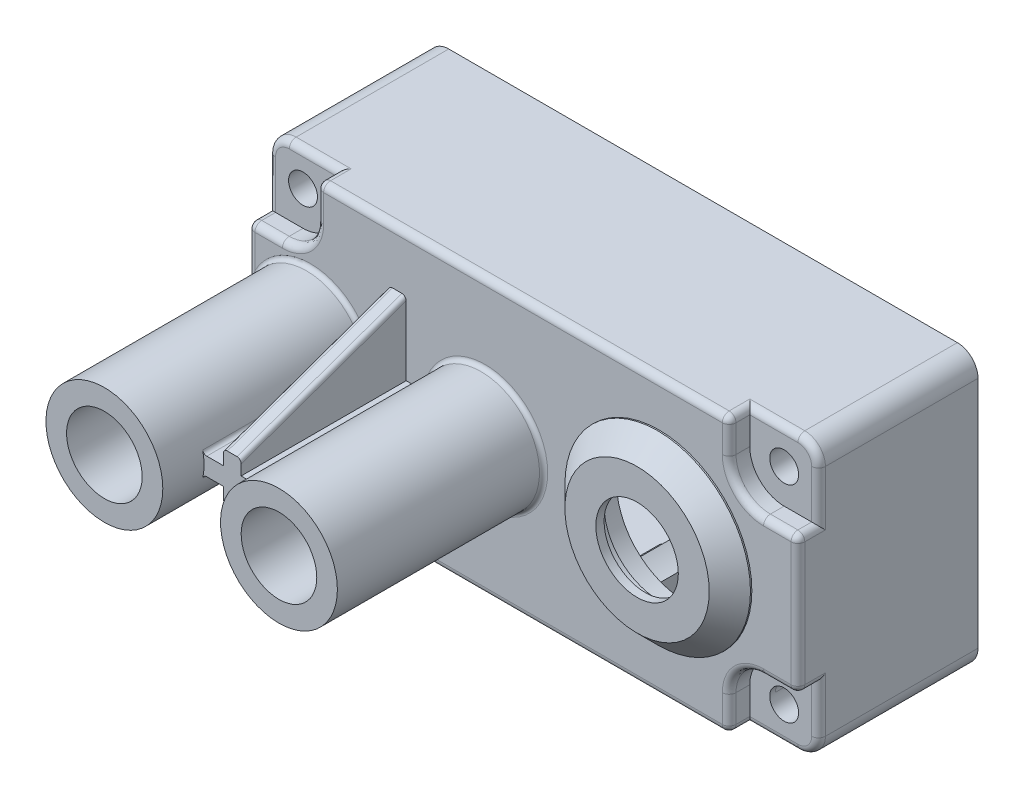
SolidWorks part; units mm, degrees
ref_plane "Front Plane" through (0, 0, 0) normal (0, 0, 1) x (1, 0, 0)
ref_plane "Top Plane" through (0, 0, 0) normal (0, 1, 0) x (1, 0, 0)
ref_plane "Right Plane" through (0, 0, 0) normal (1, 0, 0) x (0, 0, -1)
sketch "Sketch1" plane through (0, 0, 0) normal (0, 0, 1) x (1, 0, 0)
  line L0 (0, 10) -> (0, -10) construction
  line L1 (-20, 10) -> (20, 10)
  line L2 (-20, 10) -> (-20, -10)
  line L3 (-20, -10) -> (20, -10)
  line L4 (20, 10) -> (20, -10)
  dimension "D1" = 20
  dimension "D2" = 40
extrude "Extrude1" add sketch "Sketch1" along normal blind 13.1
sketch "Sketch2" plane through (0, 0, 0) normal (0, 0, -1) x (-1, 0, 0)
  line L0 (20, -10) -> (-20, -10) construction
  line L1 (-19.12, -9.12) -> (19.12, -9.12)
  line L2 (-19.12, -9.12) -> (-19.12, 9.12)
  line L3 (-19.12, 9.12) -> (19.12, 9.12)
  line L4 (19.12, -9.12) -> (19.12, 9.12)
  line L5 (-20, 10) -> (20, 10) construction
  line L6 (-20, -10) -> (-20, 10) construction
  line L7 (20, 10) -> (20, -10) construction
  dimension "D1" = 0.88
  dimension "D2" = 0.88
  dimension "D3" = 0.88
  dimension "D4" = 0.88
extrude "Cut-Extrude1" cut sketch "Sketch2" against normal blind 11.2
ref_plane "Plane2" through (0, 0, 1.3) normal (0, 0, -1) x (-1, 0, 0)
sketch "Sketch3" plane through (0, 0, 1.3) normal (0, 0, -1) x (-1, 0, 0)
  line L0 (19.12, -9.12) -> (19.12, 9.12) construction
  line L1 (-18.42, -8.42) -> (18.42, -8.42)
  line L2 (-18.42, -8.42) -> (-18.42, 8.42)
  line L3 (-18.42, 8.42) -> (18.42, 8.42)
  line L4 (18.42, -8.42) -> (18.42, 8.42)
  line L5 (19.12, 9.12) -> (-19.12, 9.12) construction
  line L6 (-19.12, 9.12) -> (-19.12, -9.12) construction
  line L7 (-19.12, -9.12) -> (19.12, -9.12) construction
  line L8 (19.12, -9.12) -> (19.12, 9.12)
  line L9 (19.12, 9.12) -> (-19.12, 9.12)
  line L10 (-19.12, 9.12) -> (-19.12, -9.12)
  line L11 (-19.12, -9.12) -> (19.12, -9.12)
  dimension "D1" = 0.7
  dimension "D2" = 0.7
  dimension "D3" = 0.7
  dimension "D4" = 0.7
extrude "Extrude2" add sketch "Sketch3" against normal up to vertex
sketch "Sketch4" plane through (0, 0, 1.3) normal (0, 0, -1) x (-1, 0, 0)
  line L0 (-18.42, -8.42) -> (18.42, -8.42) construction
  line L10 (-15.7679, -8.42) -> (-15.7679, -9.12)
  line L11 (-19.12, -9.12) -> (19.12, -9.12) construction
  line L12 (-15.7679, -9.12) -> (-19.12, -9.12)
  line L13 (-19.12, -9.12) -> (-19.12, -5.6879)
  line L14 (-19.12, 9.12) -> (-19.12, -9.12) construction
  line L15 (-19.12, -5.6879) -> (-18.5, -5.6879)
  line L16 (-18.5, 5.8479) -> (-19.12, 5.8479)
  line L17 (-19.12, 5.8479) -> (-19.12, 9.12)
  line L18 (-19.12, 9.12) -> (-15.7679, 9.12)
  line L19 (19.12, 9.12) -> (-19.12, 9.12) construction
  line L20 (-15.7679, 9.12) -> (-15.7679, 8.58)
  line L21 (15.7679, 8.58) -> (15.7679, 9.12)
  line L22 (15.7679, 9.12) -> (19.12, 9.12)
  line L23 (19.12, 9.12) -> (19.12, 5.8479)
  line L24 (19.12, 5.8479) -> (18.5, 5.8479)
  line L25 (18.5, -5.6879) -> (19.12, -5.6879)
  line L26 (19.12, -5.6879) -> (19.12, -9.12)
  line L27 (19.12, -9.12) -> (19.12, 9.12) construction
  line L28 (19.12, -9.12) -> (15.7679, -9.12)
  line L29 (15.7679, -9.12) -> (15.7679, -8.42)
  arc A0 (18.5, -5.6879) -> (15.7679, -8.42) centre (17.5, -7.42) ccw
  arc A1 (-15.7679, -8.42) -> (-15.6196, -6.7388) centre (-17.5, -7.42) ccw
  arc A2 (-15.6196, -6.7388) -> (-18.5, -5.6879) centre (-17.5, -7.42) ccw
  arc A3 (-18.5, 5.8479) -> (-16.794, 5.7088) centre (-17.5, 7.58) ccw
  arc A4 (-16.794, 5.7088) -> (-15.7679, 8.58) centre (-17.5, 7.58) ccw
  arc A5 (15.7679, 8.58) -> (18.5, 5.8479) centre (17.5, 7.58) ccw
  circle A6 centre (-17.5, -7.42) radius 1.05
  circle A7 centre (-17.5, 7.58) radius 1.05
  circle A8 centre (17.5, 7.58) radius 1.05
  circle A9 centre (17.5, -7.42) radius 1.05
  point P22 (0, 0)
  dimension "D4" = 2
  dimension "D5" = 2
  dimension "D10" = 2.7321
  dimension "D11" = 2
  dimension "D15" = 2
  dimension "D17" = 2.1
  dimension "D2" = 17.5
  dimension "D3" = 17.5
  dimension "D6" = 31.5359
  dimension "D7" = 11.5359
  dimension "D8" = 31.5359
  dimension "D9" = 11.5359
  dimension "D12" = 2.7321
  dimension "D13" = 2.7321
  dimension "D14" = 15
  dimension "D16" = 2.7321
  dimension "D18" = 17.5
  dimension "D19" = 17.5
  dimension "D20" = 15
extrude "Extrude3" add sketch "Sketch4" against normal up to vertex
sketch "Sketch5" plane through (0, 0, 11.2) normal (0, 0, -1) x (-1, 0, 0)
  line L4 (-14.5, 8.5) -> (-15.685, 8.42)
  line L8 (-18.42, 5.8042) -> (-18.5, 4.5)
  line L9 (-18.5, -4.5) -> (-18.42, -5.6442)
  line L10 (-15.7679, -8.42) -> (-14.5, -8.5)
  line L11 (14.5, 8.5) -> (15.685, 8.42)
  line L12 (18.5, 4.5) -> (18.42, 5.8042)
  line L13 (18.5, -4.5) -> (18.42, -5.6442)
  line L14 (14.5, -8.5) -> (15.7679, -8.42)
  line L15 (18.5, 4.5) -> (17.5, 4.5)
  line L16 (14.5, 7.5) -> (14.5, 8.5)
  line L17 (17.5, -4.5) -> (18.5, -4.5)
  line L18 (14.5, -8.5) -> (14.5, -7.5)
  line L19 (-14.5, -7.5) -> (-14.5, -8.5)
  line L20 (-18.5, -4.5) -> (-17.5, -4.5)
  line L21 (-14.5, 8.5) -> (-14.5, 7.5)
  line L22 (-17.5, 4.5) -> (-18.5, 4.5)
  arc A0 (-18.42, 5.8042) -> (-15.685, 8.42) centre (-17.5, 7.58) ccw construction
  arc A1 (-18.42, 5.8042) -> (-15.685, 8.42) centre (-17.5, 7.58) ccw
  arc A2 (-15.7679, -8.42) -> (-18.42, -5.6442) centre (-17.5, -7.42) ccw construction
  arc A3 (-15.7679, -8.42) -> (-18.42, -5.6442) centre (-17.5, -7.42) ccw
  arc A4 (15.685, 8.42) -> (18.42, 5.8042) centre (17.5, 7.58) ccw construction
  arc A5 (18.42, -5.6442) -> (15.7679, -8.42) centre (17.5, -7.42) ccw construction
  arc A6 (15.685, 8.42) -> (18.42, 5.8042) centre (17.5, 7.58) ccw
  arc A7 (18.42, -5.6442) -> (15.7679, -8.42) centre (17.5, -7.42) ccw
  arc A10 (14.5, 7.5) -> (17.5, 4.5) centre (17.5, 7.5) ccw
  arc A11 (17.5, -4.5) -> (14.5, -7.5) centre (17.5, -7.5) ccw
  arc A12 (-14.5, -7.5) -> (-17.5, -4.5) centre (-17.5, -7.5) ccw
  arc A13 (-17.5, 4.5) -> (-14.5, 7.5) centre (-17.5, 7.5) ccw
  point P19 (0, 0)
  dimension "D1" = 3
  dimension "D14" = 3
  dimension "D15" = 3
  dimension "D2" = 4
  dimension "D3" = 4
  dimension "D4" = 1
  dimension "D5" = 1
  dimension "D6" = 17.5
  dimension "D7" = 15
  dimension "D8" = 3
  dimension "D9" = 17.5
  dimension "D10" = 4
  dimension "D11" = 4
  dimension "D12" = 17.5
  dimension "D13" = 15
  dimension "D16" = 1
  dimension "D17" = 1
  dimension "D18" = 1
  dimension "D19" = 1
  dimension "D20" = 4
  dimension "D21" = 4
  dimension "D22" = 4
  dimension "D23" = 4
  dimension "D24" = 8.5
  dimension "D25" = 8.5
  dimension "D26" = 8.5
  dimension "D27" = 8.5
extrude "Extrude4" add sketch "Sketch5" along normal blind 0.6
sketch "Sketch7" plane through (0, 0, 0) normal (0, -1, 0) x (1, 0, 0)
  line L0 (0, 0) -> (0, 13.1) construction
  line L1 (-20, 13.1) -> (20, 13.1) construction
  line L2 (9.9, 11.2) -> (9.9, 14.7) construction
  line L3 (14.5, 11.2) -> (-14.5, 11.2) construction
  line L4 (4.9, 11.2) -> (4.9, 13.1)
  line L5 (4.9, 13.1) -> (5.9, 13.1)
  line L6 (5.9, 13.1) -> (5.9, 14.1)
  line L7 (5.9, 14.1) -> (6.9, 14.1)
  line L8 (6.9, 14.1) -> (6.9, 14.7)
  line L9 (6.9, 14.7) -> (9.9, 14.7)
  line L10 (9.9, 11.2) -> (4.9, 11.2)
  line L11 (9.9, 11.2) -> (9.9, 14.7)
  dimension "D1" = 9.9
  dimension "D2" = 1
  dimension "D3" = 3.5
  dimension "D4" = 1
  dimension "D5" = 0.6
  dimension "D6" = 10
sketch "Sketch8" plane through (0, 0, 13.1) normal (0, 0, 1) x (1, 0, 0)
  circle A0 centre (9.9, 0) radius 6.75
  circle A1 centre (9.9, 0) radius 3
  point P2 (0, 0)
  dimension "D2" = 13.5
  dimension "D3" = 6
  dimension "D1" = 9.9
extrude "Extrude5" add sketch "Sketch8" along normal blind 1.6
revolve "Cut-Revolve1" cut sketch "Sketch7" angle 360 about L2
sketch "Sketch9" plane through (0, 0, 11.2) normal (0, 0, -1) x (-1, 0, 0)
  line L0 (-7.2618, 8.5) -> (-7.2821, 8.5)
  line L1 (-7.2618, -8.5) -> (-7.2821, -8.5)
  line L8 (-7.2618, -8.5) -> (-5.654, -8.5)
  line L9 (-7.9731, -4.8298) -> (-7.2821, -8.5)
  line L10 (-5.654, -8.5) -> (-6.015, -6.5827)
  line L11 (-6.5117, -3.9445) -> (-6.385, -4.6173)
  line L12 (-6.385, 4.6173) -> (-6.5117, 3.9445)
  line L13 (-5.654, 8.5) -> (-6.015, 6.5827)
  line L14 (-5.654, 8.5) -> (-7.2618, 8.5)
  line L15 (-7.2821, 8.5) -> (-7.9731, 4.8298)
  arc A4 (-6.015, -6.5827) -> (-6.385, -4.6173) centre (-6.2, -5.6) ccw
  arc A5 (-7.9731, -4.8298) -> (-6.5117, -3.9445) centre (-9.9, 0) ccw
  arc A6 (-6.5117, 3.9445) -> (-7.9731, 4.8298) centre (-9.9, 0) ccw
  arc A7 (-6.385, 4.6173) -> (-6.015, 6.5827) centre (-6.2, 5.6) ccw
  point P17 (0, 0)
  dimension "D3" = 5.2
  dimension "D5" = 1
  dimension "D6" = 1
  dimension "D9" = 5.2
  dimension "D1" = 3.7347
  dimension "D2" = 3.7347
  dimension "D4" = 1.6078
  dimension "D7" = 1.9509
  dimension "D8" = 1.6078
  dimension "D10" = 1.6
  dimension "D11" = 1.6
  dimension "D12" = 7.8891
  dimension "D13" = 17
  dimension "D14" = 6.5117
  dimension "D15" = 7.9731
  dimension "D16" = 5.654
  dimension "D17" = 7.9731
  dimension "D18" = 3.6702
  dimension "D19" = 4.5555
  dimension "D20" = 4.5555
  dimension "D21" = 3.6702
  dimension "D22" = 0.1267
  dimension "D23" = 0.6727
  dimension "D24" = 0.1267
  dimension "D25" = 0.6846
  dimension "D26" = 1.9655
  dimension "D27" = 0.0203
  dimension "D28" = 8.5
extrude "Extrude6" add sketch "Sketch9" along normal blind 2.5
sketch "Sketch10" plane through (0, 0, 11.2) normal (0, 0, -1) x (-1, 0, 0)
  circle A2 centre (1.1, 0) radius 0.8
  circle A3 centre (1.1, 0) radius 2
  point P7 (0, 0)
  dimension "D1" = 4
  dimension "D2" = 1.6
  dimension "D3" = 1.1
extrude "Extrude7" add sketch "Sketch10" along normal blind 1.2
sketch "Sketch11" plane through (0, 0, 11.2) normal (0, 0, -1) x (-1, 0, 0)
  line L1 (8.6, -1.3229) -> (8.6, 1.3229)
  arc A4 (8.6, -1.3229) -> (8.6, 1.3229) centre (10.1, 0) ccw
  circle A5 centre (10.1, 0) radius 0.8
  point P3 (0, 0)
  dimension "D2" = 2
  dimension "D3" = 1.6
  dimension "D1" = 10.1
  dimension "D4" = 2.6458
extrude "Extrude8" add sketch "Sketch11" along normal blind 0.3
sketch "Sketch12" plane through (0, 0, 11.2) normal (0, 0, -1) x (-1, 0, 0)
  circle A0 centre (1.1, 0) radius 0.8 construction
  circle A1 centre (1.1, 0) radius 0.8
  circle A2 centre (10.1, 0) radius 0.8 construction
  circle A3 centre (10.1, 0) radius 0.8
extrude "Cut-Extrude2" cut sketch "Sketch12" against normal blind 1.4
ref_plane "Plane4" through (0, 0, 8.7) normal (0, 0, -1) x (-1, 0, 0)
sketch "Sketch13" plane through (0, 0, 8.7) normal (0, 0, -1) x (-1, 0, 0)
  line L0 (-15.7679, -8.42) -> (15.7679, -8.42) construction
  line L1 (15.685, 8.42) -> (-15.685, 8.42) construction
  line L2 (-18.42, 5.8042) -> (-18.42, -5.6442) construction
  line L3 (-7.192, -8.42) -> (-12.448, -8.42)
  line L4 (-18.42, -2.3744) -> (-18.42, 2.2081)
  line L5 (-12.448, 8.42) -> (-7.192, 8.42)
  arc A4 (-15.7679, -8.42) -> (-18.42, -5.6442) centre (-17.5, -7.42) ccw construction
  arc A5 (-18.42, 5.8042) -> (-15.685, 8.42) centre (-17.5, 7.58) ccw construction
  arc A7 (-12.448, -8.42) -> (-7.192, -8.42) centre (-9.82, -0.0831) ccw
  arc A8 (-16.8944, -5.5139) -> (-15.5682, -6.9021) centre (-9.82, -0.0831) ccw
  arc A9 (-15.5682, -6.9021) -> (-16.8944, -5.5139) centre (-17.5, -7.42) ccw
  arc A10 (-18.42, 2.2081) -> (-18.42, -2.3744) centre (-9.82, -0.0831) ccw
  arc A11 (-15.6262, 6.8809) -> (-16.7968, 5.7077) centre (-9.82, -0.0831) ccw
  arc A12 (-16.7968, 5.7077) -> (-15.6262, 6.8809) centre (-17.5, 7.58) ccw
  arc A13 (-7.192, 8.42) -> (-12.448, 8.42) centre (-9.82, -0.0831) ccw
  point P12 (0, 0)
  dimension "D2" = 8.9185
  dimension "D3" = 8.9
  dimension "D4" = 9.0669
  dimension "D5" = 8.9
  dimension "D6" = 5.2561
  dimension "D8" = 4.5826
extrude "Cut-Extrude3" cut sketch "Sketch13" along normal blind 7.4
sketch "Sketch14" plane through (0, 0, 13.1) normal (0, 0, 1) x (1, 0, 0)
  circle A0 centre (-2.75, 0) radius 2.75
  circle A1 centre (-2.75, 0) radius 4.25
  circle A2 centre (-15.45, 0) radius 4.25
  circle A3 centre (-15.45, 0) radius 2.75
  point P6 (0, 0)
  dimension "D1" = 8.5
  dimension "D2" = 8.5
  dimension "D3" = 5.5
  dimension "D4" = 5.5
  dimension "D5" = 12.7
extrude "Extrude9" add sketch "Sketch14" along normal blind 15
ref_plane "Plane5" through (-9.15, 0, 0) normal (-1, 0, 0) x (0, 0, 1)
sketch "Sketch15" plane through (-9.15, 0, 0) normal (-1, 0, 0) x (0, 0, 1)
  line L0 (0, 0) -> (33.92, 0) construction
  line L1 (13.1, 6) -> (13.1, -6)
  line L2 (13.1, 10) -> (13.1, -10) construction
  line L3 (13.1, -6.75) -> (13.1, 6.75) construction
  line L4 (25.1, 1.72) -> (25.1, -1.72)
  line L5 (25.1, 1.72) -> (13.1, 6)
  line L6 (25.1, -1.72) -> (13.1, -6)
  point P12 (25.1, 0)
  dimension "D1" = 4
  dimension "D2" = 12
  dimension "D3" = 1.72
extrude "Extrude10" add sketch "Sketch15" along normal mid plane 1.3
sketch "Sketch17" plane through (0, 0, 25.1) normal (0, 0, 1) x (1, 0, 0)
  line L0 (-15.45, 0) -> (-7.1581, 0) construction
  line L1 (-9.8, -1.72) -> (-9.8, 1.72) construction
  line L4 (-9.8, 0.65) -> (-11.25, 0.65)
  line L5 (-9.8, -0.65) -> (-11.25, -0.65)
  line L6 (-8.5, 0.65) -> (-6.95, 0.65)
  line L7 (-8.5, -1.72) -> (-8.5, 1.72) construction
  line L8 (-8.5, -0.65) -> (-6.95, -0.65)
  line L9 (-8.5, 0.65) -> (-8.5, -0.65)
  line L10 (-9.8, -0.65) -> (-9.8, 0.65)
  arc A0 (-6.95, 0.65) -> (-6.95, -0.65) centre (-2.75, 0) ccw
  circle A1 centre (-2.75, 0) radius 4.25 construction
  arc A2 (-11.25, -0.65) -> (-11.25, 0.65) centre (-15.45, 0) ccw
  circle A3 centre (-15.45, 0) radius 4.25 construction
  dimension "D1" = 0.65
extrude "Extrude11" add sketch "Sketch17" against normal up to vertex
sketch "Sketch18" plane through (0, 0, 13.1) normal (0, 0, 1) x (1, 0, 0)
  circle A2 centre (-4.5, 0) radius 1
  circle A3 centre (-15.5, 0) radius 1.5
  point P6 (0, 0)
  dimension "D1" = 2
  dimension "D2" = 3
  dimension "D3" = 4.5
  dimension "D4" = 15.5
extrude "Cut-Extrude4" cut sketch "Sketch18" against normal up to vertex
sketch "Sketch19" plane through (0, 0, 13.1) normal (0, 0, 1) x (1, 0, 0)
  line L0 (20, 0) -> (8.9309, 0) construction
  line L1 (20, -10) -> (20, 10) construction
  line L2 (17.5, 5) -> (19.5, 5)
  line L3 (19.5, 5) -> (20, 5)
  line L4 (20, 5) -> (20, 10)
  line L5 (20, 10) -> (15, 10)
  line L6 (15, -10) -> (15, -9.5)
  line L7 (15, -9.5) -> (15, -7.5)
  line L8 (20, -10) -> (15, -10)
  line L9 (20, -5) -> (20, -10)
  line L10 (19.5, -5) -> (20, -5)
  line L11 (17.5, -5) -> (19.5, -5)
  line L12 (15, 9.5) -> (15, 7.5)
  line L13 (15, 10) -> (15, 9.5)
  circle A0 centre (17.5, 7.5) radius 1.05
  circle A2 centre (17.5, -7.5) radius 1.05
  spline S0 degree 2 poles (15, 7.5) (15.0002, 7.0231) (15.1755, 6.5798) (15.3656, 6.0992) (15.7322, 5.7322) (16.0974, 5.3667) (16.5798, 5.1755) (17.0221, 5.0002) (17.5, 5) knots 0 0 0 0.25 0.25 0.5 0.5 0.75 0.75 1 1 1
  spline S1 degree 2 poles (15, -7.5) (15.0002, -7.0231) (15.1755, -6.5798) (15.3656, -6.0992) (15.7322, -5.7322) (16.0974, -5.3667) (16.5798, -5.1755) (17.0221, -5.0002) (17.5, -5) knots 0 0 0 0.25 0.25 0.5 0.5 0.75 0.75 1 1 1
  point P12 (0, 0)
  dimension "D9" = 2.1
  dimension "D4" = 2
  dimension "D5" = 2
  dimension "D6" = 5
  dimension "D7" = 5
  dimension "D8" = 17.5
  dimension "D10" = 2.5
  dimension "D11" = 2.5
  dimension "D12" = 2.5
  dimension "D13" = 2.5
  dimension "D14" = 10
extrude "Cut-Extrude5" cut sketch "Sketch19" against normal blind 1.5
mirror "Mirror1" about plane through (0, 0, 0) normal (1, 0, 0) of "Cut-Extrude5"
sketch "Sketch20" plane through (0, 0, 13.1) normal (0, 0, 1) x (1, 0, 0)
  circle A0 centre (-17.5, -7.5) radius 1.05 construction
  circle A1 centre (-17.5, 7.5) radius 1.05 construction
  circle A2 centre (17.5, 7.5) radius 1.05 construction
  circle A3 centre (17.5, -7.5) radius 1.05 construction
  circle A4 centre (-17.5, -7.5) radius 1.05
  circle A5 centre (-17.5, 7.5) radius 1.05
  circle A6 centre (17.5, 7.5) radius 1.05
  circle A7 centre (17.5, -7.5) radius 1.05
extrude "Cut-Extrude6" cut sketch "Sketch20" against normal up to vertex
fillet "Fillet1" radius 0.5 36 edges at (-18.75, -5, 13.1) (-15, -8.75, 13.1) (-18.75, 5, 13.1) (15, 8.75, 13.1) (15, -8.75, 13.1) (-15, -10, 12.35) (-17.5, -10, 11.6) (-20, -7.5, 11.6) (-20, -5, 12.35) (-20, 0, 13.1) (-17.5, 10, 11.6) (-20, 7.5, 11.6) (-20, 5, 12.35) (-15, 10, 12.35) (-15, 8.75, 13.1) (0, 10, 13.1) (17.5, 10, 11.6) (15, 10, 12.35) (20, 5, 12.35) (20, 7.5, 11.6) (18.75, 5, 13.1) (18.75, -5, 13.1) (0, -10, 13.1) (15, -10, 12.35) (20, -5, 12.35) (17.5, -10, 11.6) (20, -7.5, 11.6) (20, 0, 13.1) (-19.12, -9.12, 0.65) (-19.12, 9.12, 0.65) (19.12, 9.12, 0.65) (19.12, -9.12, 0.65)
fillet "Fillet2" radius 0.3 12 edges at (-15.1221, -4.2373, 13.1) (-19.7, 0, 13.1) (1.5, 0, 13.1) (-15.1221, 4.2373, 13.1) (-11.25, 0.65, 19.1) (-11.25, -0.65, 19.1) (-9.8, -3.86, 19.1) (-8.5, -3.86, 19.1) (-6.95, -0.65, 19.1) (-6.95, 0.65, 19.1) (-8.5, 3.86, 19.1) (-9.8, 3.86, 19.1)
fillet "Fillet4" radius 1.5 8 edges at (-19.8536, 9.8536, 11.4536) (-19.8536, -9.8536, 11.4536) (19.8536, 9.8536, 11.4536) (19.8536, -9.8536, 11.4536) (20, -10, 5.55) (20, 10, 5.55) (-20, -10, 5.55) (-20, 10, 5.55)
chamfer "Chamfer1" distance 1.5 angle 45 1 edges at (16.65, 0, 14.7)
sketch "Sketch21" plane through (0, 0, 1.3) normal (0, 0, -1) x (-1, 0, 0)
  line L0 (-18.0061, 8.42) -> (-18.13, 8.42) construction
  line L1 (-18.42, 8.0861) -> (-18.42, 8.0061) construction
  line L2 (-18.0061, 8.42) -> (-18.13, 8.42)
  line L3 (-18.42, 8.0861) -> (-18.42, 8.0061)
  line L4 (-16.87, 8.42) -> (-16.9939, 8.42) construction
  line L5 (-16.87, 8.42) -> (-16.9939, 8.42)
  arc A0 (-18.0061, 8.42) -> (-18.42, 8.0061) centre (-17.5, 7.5) ccw
  arc A1 (-18.42, 8.0061) -> (-16.4508, 7.54) centre (-17.5, 7.5) ccw construction
  arc A2 (-18.13, 8.42) -> (-18.42, 8.0861) centre (-17.5, 7.58) ccw construction
  arc A3 (-18.13, 8.42) -> (-18.42, 8.0861) centre (-17.5, 7.58) ccw
  arc A4 (-16.4508, 7.54) -> (-16.87, 8.42) centre (-17.5, 7.58) ccw construction
  arc A5 (-16.4508, 7.54) -> (-16.87, 8.42) centre (-17.5, 7.58) ccw
  arc A6 (-16.4508, 7.54) -> (-16.9939, 8.42) centre (-17.5, 7.5) ccw
extrude "Extrude12" add sketch "Sketch21" against normal up to surface (10.3 mm away)
